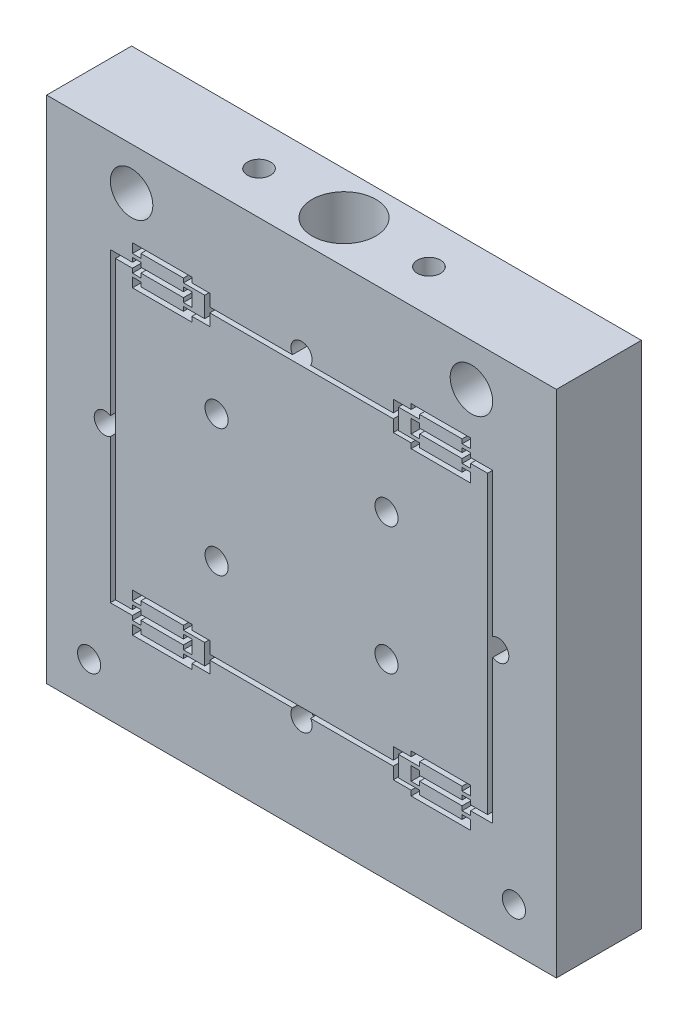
SolidWorks part; units mm, degrees
ref_plane "Front Plane" through (0, 0, 0) normal (0, 0, 1) x (1, 0, 0)
ref_plane "Top Plane" through (0, 0, 0) normal (0, 1, 0) x (1, 0, 0)
ref_plane "Right Plane" through (0, 0, 0) normal (1, 0, 0) x (0, 0, -1)
sketch "Sketch1" plane through (0, 0, 0) normal (0, 0, 1) x (1, 0, 0)
  line L1 (-38.1, 38.1) -> (38.1, 38.1)
  line L2 (-38.1, 38.1) -> (-38.1, -38.1)
  line L3 (-38.1, -38.1) -> (38.1, -38.1)
  line L4 (38.1, 38.1) -> (38.1, -38.1)
  dimension "D1" = 38.1
  dimension "D2" = 38.1
  dimension "D3" = 38.1
  dimension "D4" = 38.1
extrude "Boss-Extrude1" add sketch "Sketch1" along normal mid plane 12.7
sketch "Sketch2" plane through (0, 0, 6.35) normal (0, 0, 1) x (1, 0, 0)
  line L0 (16.383, 23.495) -> (17.653, 23.495)
  line L1 (28.575, 22.86) -> (28.575, -22.86)
  line L2 (0, 0) -> (38.1, 0) construction
  line L3 (25.273, -22.86) -> (28.575, -22.86)
  line L4 (25.273, -22.098) -> (27.813, -22.098)
  line L5 (27.813, -22.098) -> (27.813, 22.098)
  line L6 (17.653, 23.495) -> (17.653, 22.86)
  line L7 (16.383, 21.463) -> (16.383, 23.495)
  line L8 (38.1, -38.1) -> (38.1, 38.1) construction
  line L9 (17.653, 22.86) -> (24.003, 22.86)
  line L10 (24.003, 22.86) -> (24.003, 23.495)
  line L11 (24.003, 23.495) -> (25.273, 23.495)
  line L12 (25.273, 23.495) -> (25.273, 22.86)
  line L13 (25.273, 22.86) -> (28.575, 22.86)
  line L14 (16.383, 21.463) -> (17.653, 21.463)
  line L15 (17.653, 21.463) -> (17.653, 22.098)
  line L16 (17.653, 22.098) -> (24.003, 22.098)
  line L17 (24.003, 22.098) -> (24.003, 21.463)
  line L18 (24.003, 21.463) -> (25.273, 21.463)
  line L19 (25.273, 21.463) -> (25.273, 22.098)
  line L20 (25.273, 22.098) -> (27.813, 22.098)
  line L21 (17.653, -23.495) -> (17.653, -22.86)
  line L22 (17.653, -22.86) -> (24.003, -22.86)
  line L23 (24.003, -22.86) -> (24.003, -23.495)
  line L24 (24.003, -23.495) -> (25.273, -23.495)
  line L25 (25.273, -23.495) -> (25.273, -22.86)
  line L26 (25.273, -21.463) -> (25.273, -22.098)
  line L27 (24.003, -21.463) -> (25.273, -21.463)
  line L28 (24.003, -22.098) -> (24.003, -21.463)
  line L29 (17.653, -22.098) -> (24.003, -22.098)
  line L30 (17.653, -21.463) -> (17.653, -22.098)
  line L31 (16.383, -21.463) -> (17.653, -21.463)
  line L32 (16.383, -21.463) -> (16.383, -23.495)
  line L33 (16.383, -23.495) -> (17.653, -23.495)
  dimension "D1" = 0.762
  dimension "D2" = 1.27
  dimension "D3" = 9.525
  dimension "D4" = 1.27
  dimension "D5" = 2.54
  dimension "D6" = 0.762
  dimension "D7" = 22.86
  dimension "D8" = 0.635
  dimension "D9" = 0.635
  dimension "D10" = 6.35
extrude "Cut-Extrude1" cut sketch "Sketch2" against normal up to next
mirror "Mirror1" about plane through (0, 0, 0) normal (1, 0, 0) of "Cut-Extrude1"
sketch "Sketch3" plane through (0, 0, 6.35) normal (0, 0, 1) x (1, 0, 0)
  line L0 (25.273, 20.955) -> (25.273, 19.558)
  line L1 (25.273, 25.4) -> (16.383, 25.4)
  line L2 (16.383, 25.4) -> (16.383, 24.638)
  line L3 (-13.716, 22.86) -> (13.716, 22.86)
  line L6 (14.478, 24.003) -> (17.653, 24.003)
  line L7 (17.653, 24.003) -> (17.653, 24.638)
  line L8 (0, 38.1) -> (0, 0) construction
  line L9 (38.1, 38.1) -> (-38.1, 38.1) construction
  line L10 (25.273, 22.86) -> (25.273, 23.495) construction
  line L11 (24.003, 22.098) -> (24.003, 21.463) construction
  line L12 (17.653, 21.463) -> (17.653, 22.098) construction
  line L13 (13.716, 22.098) -> (-13.716, 22.098)
  line L14 (16.383, 24.638) -> (13.716, 24.638)
  line L15 (13.716, 24.638) -> (13.716, 22.86)
  line L16 (25.273, 25.4) -> (25.273, 24.003)
  line L17 (17.653, 24.638) -> (24.003, 24.638)
  line L18 (14.478, 24.003) -> (14.478, 20.955)
  line L19 (14.478, 20.955) -> (17.653, 20.955)
  line L20 (24.003, 21.463) -> (25.273, 21.463) construction
  line L21 (25.273, 23.495) -> (24.003, 23.495) construction
  line L25 (16.383, 23.495) -> (16.383, 21.463) construction
  line L26 (24.003, 24.638) -> (24.003, 24.003)
  line L27 (24.003, 24.003) -> (25.273, 24.003)
  line L28 (17.653, 20.955) -> (17.653, 20.32)
  line L29 (17.653, 20.32) -> (24.003, 20.32)
  line L30 (24.003, 20.32) -> (24.003, 20.955)
  line L31 (24.003, 20.955) -> (25.273, 20.955)
  line L32 (-16.383, 19.558) -> (-25.273, 19.558)
  line L33 (-16.383, 20.32) -> (-16.383, 19.558)
  line L34 (-25.273, 20.955) -> (-25.273, 19.558)
  line L35 (-24.003, 20.955) -> (-25.273, 20.955)
  line L36 (-24.003, 20.32) -> (-24.003, 20.955)
  line L37 (-17.653, 20.32) -> (-24.003, 20.32)
  line L38 (-17.653, 20.955) -> (-17.653, 20.32)
  line L39 (-14.478, 20.955) -> (-17.653, 20.955)
  line L40 (-14.478, 24.003) -> (-14.478, 20.955)
  line L41 (-14.478, 24.003) -> (-17.653, 24.003)
  line L42 (-17.653, 24.003) -> (-17.653, 24.638)
  line L43 (-17.653, 24.638) -> (-24.003, 24.638)
  line L44 (-24.003, 24.638) -> (-24.003, 24.003)
  line L45 (-24.003, 24.003) -> (-25.273, 24.003)
  line L46 (-25.273, 25.4) -> (-25.273, 24.003)
  line L47 (-13.716, 20.32) -> (-16.383, 20.32)
  line L48 (-13.716, 22.098) -> (-13.716, 20.32)
  line L49 (17.653, 22.098) -> (24.003, 22.098) construction
  line L50 (24.003, 22.86) -> (17.653, 22.86) construction
  line L51 (13.716, 22.098) -> (13.716, 20.32)
  line L52 (13.716, 20.32) -> (16.383, 20.32)
  line L53 (16.383, 20.32) -> (16.383, 19.558)
  line L54 (16.383, 19.558) -> (25.273, 19.558)
  line L55 (-13.716, 24.638) -> (-13.716, 22.86)
  line L56 (-16.383, 24.638) -> (-13.716, 24.638)
  line L57 (-16.383, 25.4) -> (-16.383, 24.638)
  line L58 (-25.273, 25.4) -> (-16.383, 25.4)
  point P26 (0, 17.78)
  point P35 (0, 19.05)
  dimension "D1" = 0.762
  dimension "D2" = 0.762
  dimension "D3" = 0.508
  dimension "D4" = 0.508
  dimension "D5" = 0.635
  dimension "D6" = 0.635
  dimension "D7" = 1.905
  dimension "D8" = 0.762
extrude "Cut-Extrude2" cut sketch "Sketch3" against normal up to next
mirror "Mirror2" about plane through (0, 0, 0) normal (0, 1, 0) of "Cut-Extrude2"
hole_wizard "1/4 (0.25) Diameter Hole1" positions "Sketch5" profile "Sketch4" hole size "1/4" standard "ANSI Inch"
sketch "Sketch5" plane through (0, 0, 6.35) normal (0, 0, 1) x (1, 0, 0)
  line L0 (38.1, 38.1) -> (-38.1, 38.1) construction
  point P0 (-25.4, 31.75)
  point P2 (25.4, 31.75)
  dimension "D1" = 25.4
  dimension "D2" = 25.4
  dimension "D3" = 6.35
sketch "Sketch4" plane through (-25.4, 31.75, 6.35) normal (1, 0, 0) x (0, -1, 0)
  line L0 (0, 0) -> (0, 12.7)
  line L1 (0, 12.7) -> (3.175, 12.7)
  line L2 (3.175, 12.7) -> (3.175, 0)
  line L5 (3.175, 0) -> (0, 0)
  line L11 (0, -6.35) -> (0, 107.95) construction
  dimension "Thru Hole Dia." = 6.35
  dimension "Thru Hole Depth" = 12.7
hole_wizard "#8-32 Tapped Hole1" positions "Sketch7" profile "Sketch6" tap size "#8-32" standard "ANSI Inch"
sketch "Sketch7" plane through (0, 0, 6.35) normal (0, 0, 1) x (1, 0, 0)
  line L0 (-38.1, 38.1) -> (-38.1, -38.1) construction
  line L1 (38.1, -38.1) -> (38.1, 38.1) construction
  line L2 (-38.1, -38.1) -> (38.1, -38.1) construction
  point P0 (-12.7, 9.525)
  point P2 (12.7, 9.525)
  point P4 (12.7, -9.525)
  point P6 (-12.7, -9.525)
  point P20 (-31.75, -31.75)
  point P22 (31.75, -31.75)
  dimension "D1" = 12.7
  dimension "D2" = 12.7
  dimension "D3" = 9.525
  dimension "D4" = 9.525
  dimension "D5" = 6.35
  dimension "D6" = 6.35
  dimension "D7" = 6.35
sketch "Sketch6" plane through (-12.7, 9.525, 6.35) normal (1, 0, 0) x (0, -1, 0)
  line L0 (0, 0) -> (0, 12.7)
  line L1 (0, 12.7) -> (1.7272, 12.7)
  line L2 (1.7272, 12.7) -> (1.7272, 0)
  line L5 (1.7272, 0) -> (0, 0)
  line L11 (0, -6.35) -> (0, 107.95) construction
  dimension "Thru Tap Drill Dia." = 3.4544
  dimension "Thru Tap Drill Depth" = 12.7
sketch "Sketch12" plane through (0, 38.1, 0) normal (0, 1, 0) x (1, 0, 0)
  circle A0 centre (0, 0) radius 3.81
extrude "Cut-Extrude7" cut sketch "Sketch12" against normal blind 20.828
hole_wizard "#8-32 Tapped Hole2" positions "Sketch15" profile "Sketch14" tap size "#8-32" standard "ANSI Inch"
sketch "Sketch15" plane through (0, 38.1, 0) normal (0, 1, 0) x (1, 0, 0)
  point P0 (-12.7, 0)
  point P2 (12.7, 0)
  dimension "D1" = 12.7
  dimension "D2" = 12.7
sketch "Sketch14" plane through (-12.7, 38.1, 0) normal (1, 0, 0) x (0, 0, 1)
  line L0 (0, 0) -> (0, 11.1978)
  line L1 (0, 11.1978) -> (1.7272, 10.16)
  line L2 (1.7272, 10.16) -> (1.7272, 0)
  line L5 (1.7272, 0) -> (0, 0)
  line L10 (0, 11.1978) -> (-1.7272, 10.16) construction
  line L11 (0, -6.35) -> (0, 107.95) construction
  dimension "Tap Drill Dia." = 3.4544
  dimension "Tap Drill Depth" = 10.16
  dimension "Drill Angle" = 118
mirror "Mirror4" about plane through (0, 0, 0) normal (0, 1, 0) of "#8-32 Tapped Hole2", "Cut-Extrude7"
sketch "Sketch16" plane through (0, 0, 6.35) normal (0, 0, 1) x (1, 0, 0)
  line L0 (27.813, 22.098) -> (27.813, -22.098) construction
  line L1 (-13.716, 22.098) -> (13.716, 22.098) construction
  line L2 (-13.716, -22.098) -> (13.716, -22.098) construction
  line L3 (-27.813, 22.098) -> (-27.813, -22.098) construction
  circle A0 centre (0, 23.6855) radius 1.5875
  circle A1 centre (29.4005, 0) radius 1.5875
  circle A2 centre (-29.4005, 0) radius 1.5875
  circle A3 centre (0, -23.6855) radius 1.5875
extrude "Cut-Extrude8" cut sketch "Sketch16" against normal through all
sketch "Sketch17" plane through (0, 38.1, 0) normal (0, 1, 0) x (1, 0, 0)
  circle A0 centre (0, 0) radius 4.7625
extrude "Cut-Extrude9" cut sketch "Sketch17" against normal blind 12.7
mirror "Mirror5" about plane through (0, 0, 0) normal (0, 1, 0) of "Cut-Extrude9"
